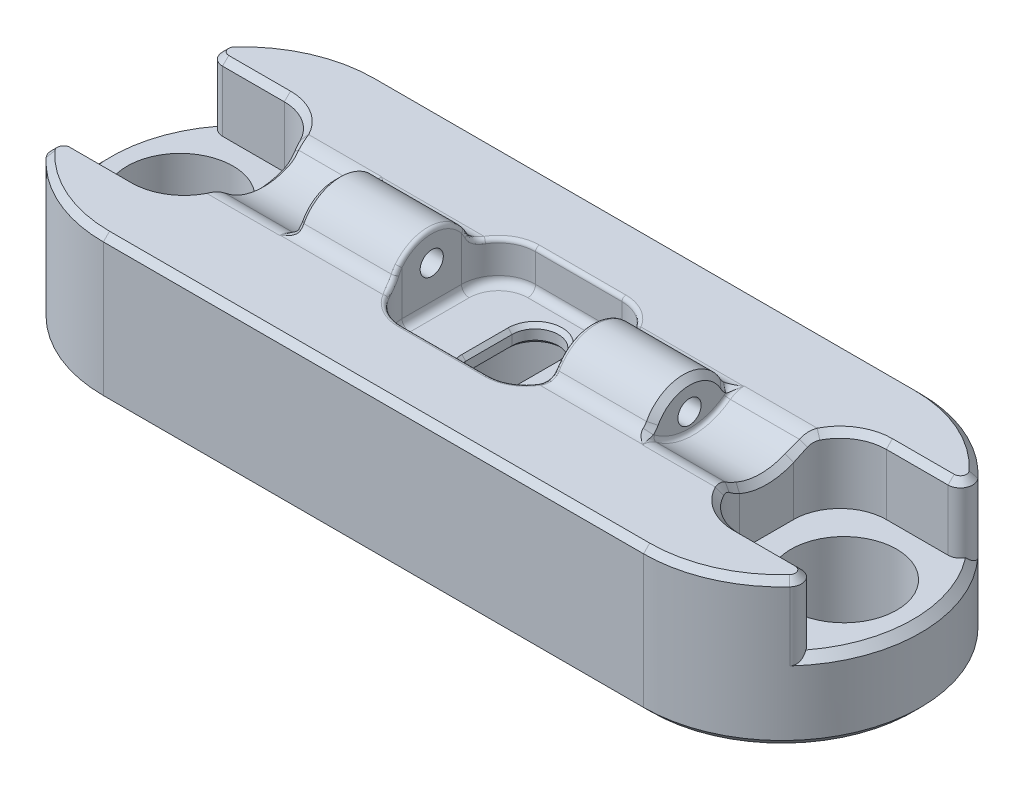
SolidWorks part; units mm, degrees
ref_plane "Front Plane" through (0, 0, 0) normal (0, 0, 1) x (1, 0, 0)
ref_plane "Top Plane" through (0, 0, 0) normal (0, 1, 0) x (1, 0, 0)
ref_plane "Right Plane" through (0, 0, 0) normal (1, 0, 0) x (0, 0, -1)
sketch "Sketch1" plane through (0, 0, 0) normal (1, 0, 0) x (0, 0, -1)
  line L0 (0, 0) -> (0, 11.8405) construction
  line L1 (-8.975, 0) -> (8.975, 0)
  line L2 (-8.975, 0) -> (-8.975, 9.52)
  line L3 (-8.975, 9.52) -> (-3.2706, 9.52)
  line L4 (8.975, 0) -> (8.975, 9.52)
  line L5 (3.2706, 9.52) -> (8.975, 9.52)
  arc A0 (2.3867, 10.0524) -> (-2.3867, 10.0524) centre (0, 8.79) ccw
  arc A1 (2.3867, 10.0524) -> (3.2706, 9.52) centre (3.2706, 10.52) ccw
  arc A2 (-3.2706, 9.52) -> (-2.3867, 10.0524) centre (-3.2706, 10.52) ccw
  circle A3 centre (0, 9.6012) radius 0.8 construction
  dimension "D3" = 8.79
  dimension "D4" = 2.7
  dimension "D5" = 1
  dimension "D6" = 9.6012
  dimension "D7" = 1.6
  dimension "D1" = 17.95
  dimension "D2" = 9.52
extrude "Boss-Extrude1" add sketch "Sketch1" along normal mid plane 52.95
sketch "Sketch2" plane through (0, 0, 0) normal (0, 1, 0) x (1, 0, 0)
  line L2 (-17.5, 8.975) -> (-30, 8.975)
  line L4 (-30, 8.975) -> (-30, -8.975)
  line L5 (-30, -8.975) -> (-17.5, -8.975)
  line L6 (26.475, -8.975) -> (-26.475, -8.975) construction
  line L8 (-26.475, 2.3867) -> (-26.475, -2.3867) construction
  line L9 (26.475, 8.975) -> (-26.475, 8.975) construction
  line L10 (26.475, 0) -> (-26.475, 0) construction
  line L11 (17.5, 8.975) -> (30, 8.975)
  line L12 (30, 8.975) -> (30, -8.975)
  line L13 (30, -8.975) -> (17.5, -8.975)
  line L15 (26.475, -2.3867) -> (26.475, 2.3867) construction
  arc A2 (-17.5, 8.975) -> (-17.5, -8.975) centre (-17.5, 0) ccw
  arc A3 (17.5, -8.975) -> (17.5, 8.975) centre (17.5, 0) ccw
  dimension "D1" = 30
extrude "Cut-Extrude1" cut sketch "Sketch2" along normal blind 38
sketch "Sketch4" plane through (0, 0, 0) normal (1, 0, 0) x (0, 0, -1)
  line L0 (-8.975, 0) -> (8.975, 0) construction
  circle A0 centre (0, 9.6012) radius 0.75
  dimension "D1" = 1.5
  dimension "D2" = 9.6012
extrude "Cut-Extrude2" cut sketch "Sketch4" against normal through all both and the other way through all
ref_plane "Plane2" through (0, 11.49, 0) normal (0, 1, 0) x (1, 0, 0)
sketch "Sketch5" plane through (0, 11.49, 0) normal (0, 1, 0) x (1, 0, 0)
  line L0 (0, 4.325) -> (0, -4.325) construction
  line L1 (-2.8, 4.325) -> (2.8, 4.325)
  line L2 (-5.2, 1.925) -> (-5.2, -1.925)
  line L3 (-2.8, -4.325) -> (2.8, -4.325)
  line L4 (5.2, 1.925) -> (5.2, -1.925)
  line L5 (-5.2, 0) -> (5.2, 0) construction
  arc A0 (-2.8, 4.325) -> (-5.2, 1.925) centre (-2.8, 1.925) ccw
  arc A1 (-2.8, -4.325) -> (-5.2, -1.925) centre (-2.8, -1.925) cw
  arc A2 (2.8, -4.325) -> (5.2, -1.925) centre (2.8, -1.925) ccw
  arc A3 (5.2, 1.925) -> (2.8, 4.325) centre (2.8, 1.925) ccw
  point P11 (-5.2, 4.325)
  point P14 (-5.2, -4.325)
  point P19 (5.2, 4.325)
  dimension "D3" = 2.4
  dimension "D1" = 8.65
  dimension "D2" = 10.4
extrude "Cut-Extrude3" cut sketch "Sketch5" against normal blind 4.55
sketch "Sketch6" plane through (0, 0, 0) normal (0, -1, 0) x (1, 0, 0)
  circle A0 centre (0, 0) radius 6.4
  dimension "D1" = 12.8
extrude "Cut-Extrude4" cut sketch "Sketch6" against normal blind 5.81
sketch "Sketch7" plane through (0, 0, 0) normal (0, -1, 0) x (1, 0, 0)
  line L0 (-26.475, 0) -> (-5.2, 0) construction
  line L1 (-11.3515, 0) -> (-24.5596, 0) construction
  circle A0 centre (-21.5, 0) radius 3.425
  circle A1 centre (21.5, 0) radius 3.425
  dimension "D1" = 43
  dimension "D3" = 6.85
  dimension "D2" = 21.5
extrude "Cut-Extrude5" cut sketch "Sketch7" against normal through all
ref_plane "Plane3" through (0, 5.1816, 0) normal (0, -1, 0) x (-1, 0, 0)
sketch "Sketch8" plane through (0, 5.1816, 0) normal (0, -1, 0) x (-1, 0, 0)
  line L0 (30, 4.75) -> (30, -4.75)
  line L1 (30, -4.75) -> (19.5, -4.75)
  line L2 (16.5, -1.75) -> (16.5, 1.75)
  line L3 (19.5, 4.75) -> (30, 4.75)
  line L4 (0, 0) -> (0, -8.975) construction
  line L5 (-17.5, -8.975) -> (17.5, -8.975) construction
  line L6 (0, 0) -> (21.3919, 0) construction
  line L7 (-30, -4.75) -> (-19.5, -4.75)
  line L8 (-30, 4.75) -> (-30, -4.75)
  line L9 (-19.5, 4.75) -> (-30, 4.75)
  line L10 (-16.5, -1.75) -> (-16.5, 1.75)
  arc A0 (19.5, -4.75) -> (16.5, -1.75) centre (19.5, -1.75) cw
  arc A1 (16.5, 1.75) -> (19.5, 4.75) centre (19.5, 1.75) cw
  arc A2 (-19.5, -4.75) -> (-16.5, -1.75) centre (-19.5, -1.75) ccw
  arc A3 (-16.5, 1.75) -> (-19.5, 4.75) centre (-19.5, 1.75) ccw
  dimension "D3" = 3
  dimension "D1" = 9.5
  dimension "D2" = 16.5
  dimension "D4" = 30
extrude "Cut-Extrude6" cut sketch "Sketch8" against normal through all
sketch "Sketch11" plane through (16.5, 0, 0) normal (1, 0, 0) x (0, 0, -1)
  line L0 (4.75, 9.52) -> (3.2706, 9.52) construction
  line L1 (4, 9.52) -> (3.3, 9.52)
  line L2 (4, 9.52) -> (4, 12.42)
  line L3 (0, 0) -> (0, 13.9807) construction
  line L4 (-4, 9.52) -> (-4, 12.42)
  line L5 (-4, 9.52) -> (-3.3, 9.52)
  line L6 (8.975, 9.52) -> (4.75, 9.52) construction
  arc A0 (4, 12.42) -> (-4, 12.42) centre (0, 12.42) ccw
  arc A1 (3.3, 9.52) -> (2.4, 9.22) centre (3.3, 8.02) ccw
  arc A2 (-3.3, 9.52) -> (-2.4, 9.22) centre (-3.3, 8.02) cw
  arc A3 (-2.4, 9.22) -> (2.4, 9.22) centre (0, 12.42) ccw
  dimension "D1" = 8
  dimension "D3" = 1.5
  dimension "D2" = 2.9
  dimension "D4" = 4
extrude "Cut-Extrude9" cut sketch "Sketch11" against normal mid plane 10
fillet "Fillet4" radius 0.25 3 edges at (11.5, 9.443, 2.8257) (11.5, 9.443, -2.8257) (11.5, 8.42, 0)
sketch "Sketch12" plane through (0, 6.94, 0) normal (0, 1, 0) x (1, 0, 0)
  line L0 (-2.5, 0) -> (2.5, 0) construction
  line L5 (0, 1.5) -> (0, -1.5) construction
  line L6 (0, 1.5) -> (0, -1.5) construction
  line L7 (1.5, 1.5) -> (1.5, -1.5)
  line L8 (-1.5, 1.5) -> (-1.5, -1.5)
  arc A3 (1.5, 1.5) -> (-1.5, 1.5) centre (0, 1.5) ccw
  arc A4 (-1.5, -1.5) -> (1.5, -1.5) centre (0, -1.5) ccw
  point P0 (0, 0)
  dimension "D1" = 3
  dimension "D2" = 6
extrude "Cut-Extrude10" cut sketch "Sketch12" against normal through all
mirror "Mirror1" about plane through (0, 0, 0) normal (1, 0, 0) of "Fillet4", "Cut-Extrude9"
fillet "Fillet5" radius 0.8 4 edges at (-25.115, 7.3508, -4.75) (-25.115, 7.3508, 4.75) (25.115, 7.3508, -4.75) (25.115, 7.3508, 4.75)
chamfer "Chamfer1" distance 0.5 angle 45 2 edges at (26.475, 5.1816, 0) (-26.475, 5.1816, 0)
chamfer "Chamfer2" distance 0.4 angle 45 42 edges at (21.5012, 9.52, 4.75) (18.0252, 9.52, 4.3625) (18.0252, 9.52, -4.3625) (21.5012, 9.52, -4.75) (-21.5012, 9.52, 4.75) (-18.0252, 9.52, 4.3625) (-18.0252, 9.52, -4.3625) (-21.5012, 9.52, -4.75) (21.0962, 9.52, -8.223) (-21.0962, 9.52, -8.223) (0, 9.52, -8.975) (21.0962, 9.52, 8.223) (-21.0962, 9.52, 8.223) (0, 9.52, 8.975) (-11.5, 9.8416, 2.536) (-11.5, 9.8416, -2.536) (-11.5, 11.49, 0) (11.5, 9.8416, -2.536) (11.5, 9.8416, 2.536) (11.5, 11.49, 0) (16.6941, 9.4382, 2.8115) (16.5, 8.42, 0) (16.71, 9.4517, -2.8526) (-11.5991, 9.548, -3.0357) (-11.517, 9.6156, 2.844) (11.5991, 9.548, 3.0357) (11.517, 9.6156, -2.844) (-16.6941, 9.4382, 2.8115) (-16.5, 8.42, 0) (-16.71, 9.4517, -2.8526) (24.2353, 9.52, -5.2295) (-24.2353, 9.52, -5.2295) (24.2353, 9.52, 5.2295) (-24.2353, 9.52, 5.2295)
fillet "Fillet1" radius 0.25 16 edges at (0, 9.52, -4.325) (-3.9248, 9.52, -4.0451) (-5.0202, 9.6192, -2.8364) (-5.2, 11.49, 0) (-5.0877, 9.7354, 2.6506) (-3.9248, 9.52, 4.0451) (0, 9.52, 4.325) (3.9248, 9.52, 4.0451) (5.0202, 9.6192, 2.8364) (5.2, 11.49, 0) (5.0877, 9.7354, -2.6506) (3.9248, 9.52, -4.0451)
chamfer "Chamfer3" distance 0.5 angle 45 4 edges at (0, 0, -8.975) (26.475, 0, 0) (-26.475, 0, 0) (0, 0, 8.975)
chamfer "Chamfer4" distance 0.25 angle 45 11 edges at (21.5, 0, -3.425) (0, 0, -6.4) (-21.5, 0, -3.425) (0, 5.81, 3) (-1.5, 5.81, 0) (1.5, 5.81, 0) (0, 5.81, -3) (0, 6.94, 3) (1.5, 6.94, 0) (-1.5, 6.94, 0) (0, 6.94, -3)
fillet "Fillet3" radius 0.5 8 edges at (0, 6.94, -4.325) (4.4971, 6.94, -3.6221) (5.2, 6.94, 0) (4.4971, 6.94, 3.6221) (0, 6.94, 4.325) (-4.4971, 6.94, 3.6221) (-5.2, 6.94, 0) (-4.4971, 6.94, -3.6221)
fillet "Fillet6" radius 0.3 1 edges at (0, 5.81, -6.4)
